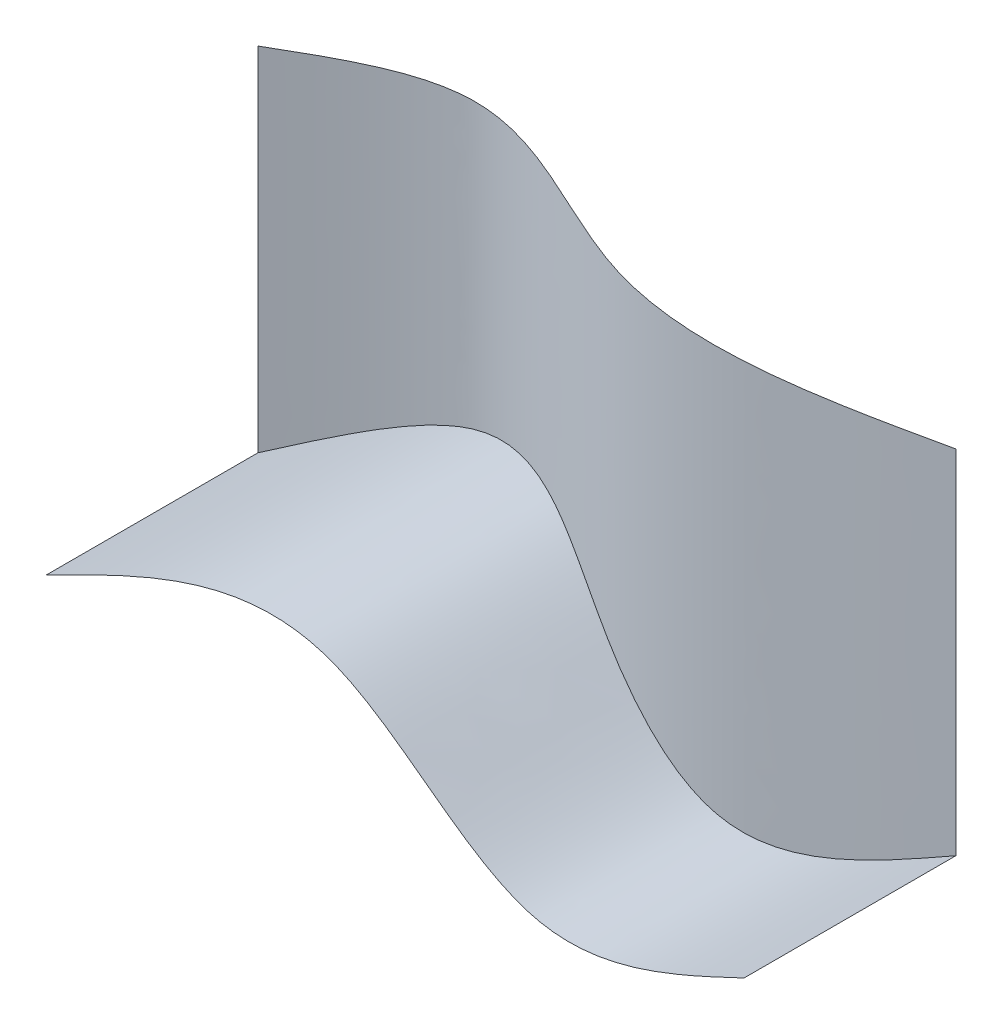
SolidWorks part; units mm, degrees
ref_plane "Front" through (0, 0, 0) normal (0, 0, 1) x (1, 0, 0)
ref_plane "Top" through (0, 0, 0) normal (0, 1, 0) x (1, 0, 0)
ref_plane "Right" through (0, 0, 0) normal (1, 0, 0) x (0, 0, -1)
sketch "Sketch1" plane through (0, 0, 0) normal (0, 0, 1) x (1, 0, 0)
  spline_without_curve S0
surface "Surface-Extrude1" sketch "Sketch1" parameters "D1"=101
sketch "Sketch2" plane through (0, 0, 0) normal (0, 1, 0) x (1, 0, 0)
  line L0 (-79.4813, -50.5) -> (-79.4813, 50.5) construction
  line L1 (86.9618, 50.5) -> (86.9618, -50.5) construction
  spline_without_curve S0
surface "Surface-Extrude2" sketch "Sketch2" parameters "D1"=168.0366
surface "Surface-Trim1"
